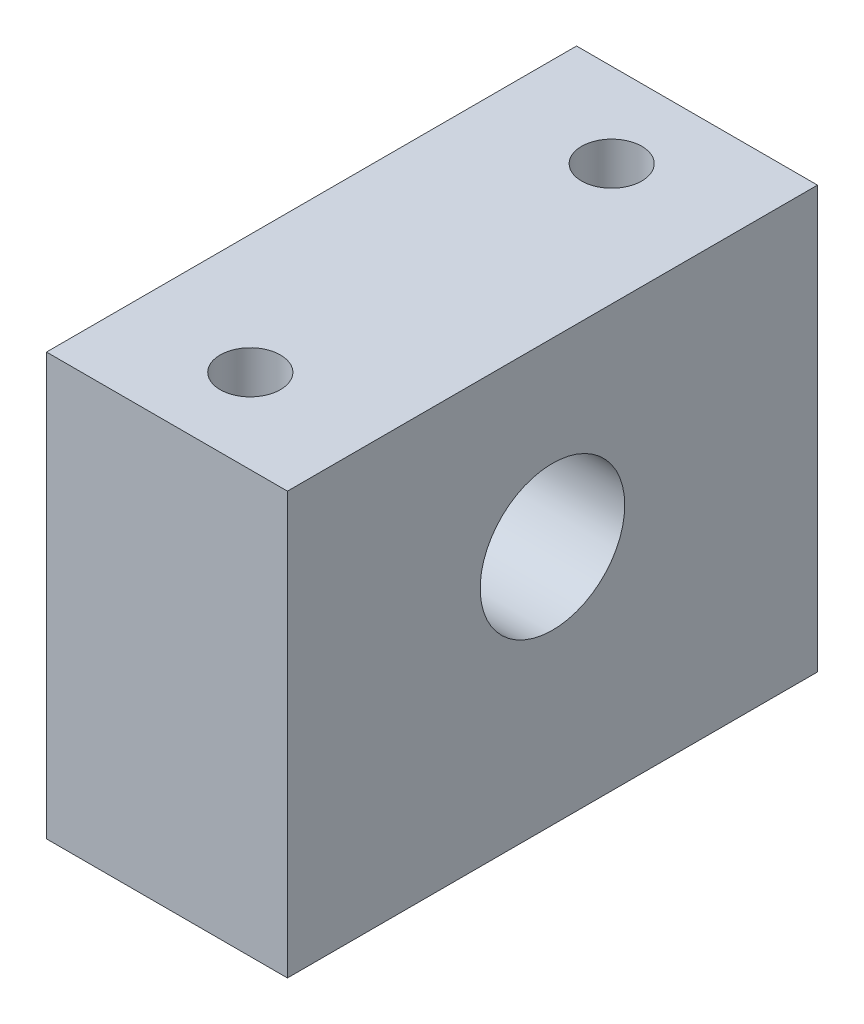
SolidWorks part; units mm, degrees
ref_plane "Face" through (0, 0, 0) normal (0, 0, 1) x (1, 0, 0)
ref_plane "Dessus" through (0, 0, 0) normal (0, 1, 0) x (1, 0, 0)
ref_plane "Droite" through (0, 0, 0) normal (1, 0, 0) x (0, 0, -1)
sketch "Esquisse1" plane through (0, 0, 0) normal (0, 0, 1) x (1, 0, 0)
  line L1 (-39.472, -3.5749) -> (-19.472, -3.5749)
  line L2 (-39.472, -3.5749) -> (-39.472, -38.5749)
  line L3 (-39.472, -38.5749) -> (-19.472, -38.5749)
  line L4 (-19.472, -3.5749) -> (-19.472, -38.5749)
  dimension "D1" = 20
  dimension "D2" = 35
extrude "Base-Extrusion" add sketch "Esquisse1" along normal blind 44
sketch "Esquisse2" plane through (-19.472, 0, 0) normal (1, 0, 0) x (0, 0, -1)
  line L0 (0, -38.5749) -> (0, -3.5749) construction
  line L1 (-44, -38.5749) -> (0, -38.5749) construction
  circle A0 centre (-22, -18.5749) radius 6
  dimension "D1" = 12
  dimension "D2" = 22
  dimension "D3" = 20
extrude "Enlèv. mat.-Extru.1" cut sketch "Esquisse2" against normal blind 44
hole_wizard "Trou taraudé M6x1.01" positions "Esquisse4" profile "Esquisse3" tap size "M6x1.0" standard "ISO"
sketch "Esquisse4" plane through (0, -38.5749, 0) normal (0, -1, 0) x (1, 0, 0)
  line L0 (-39.472, 0) -> (-19.472, 0) construction
  point P0 (-29.5557, 37)
  point P1 (-29.5557, 7)
  dimension "D1" = 30
  dimension "D2" = 7
sketch "Esquisse3" plane through (-29.5557, -38.5749, 37) normal (1, 0, 0) x (0, 0, -1)
  line L0 (0, 0) -> (0, 35)
  line L1 (0, 35) -> (2.5, 35)
  line L2 (2.5, 35) -> (2.5, 0)
  line L5 (2.5, 0) -> (0, 0)
  line L11 (0, -6.35) -> (0, 107.95) construction
  dimension "Diamètre du perçage jusqu'au prochain" = 5
  dimension "Profondeur du perçage jusqu'au prochain" = 35
